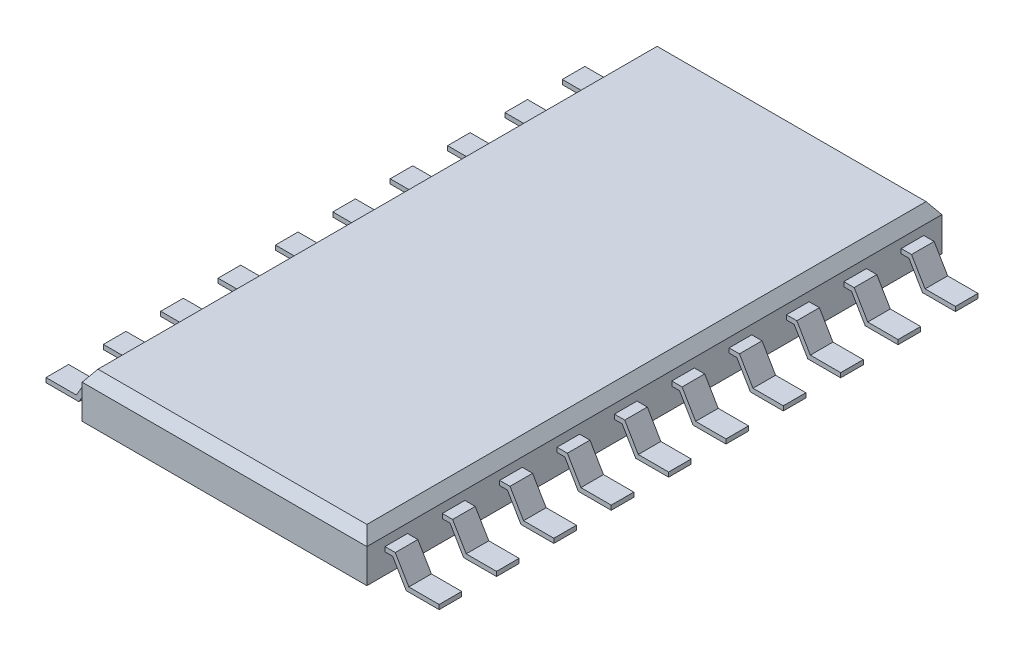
SolidWorks part; units mm, degrees
ref_plane "Front Plane" through (0, 0, 0) normal (0, 0, 1) x (1, 0, 0)
ref_plane "Top Plane" through (0, 0, 0) normal (0, 1, 0) x (1, 0, 0)
ref_plane "Right Plane" through (0, 0, 0) normal (1, 0, 0) x (0, 0, -1)
sketch "Sketch1" plane through (0, 0, 0) normal (0, 1, 0) x (1, 0, 0)
  line L0 (0, 6.8835) -> (0, -6.8835) construction
  line L1 (-5.5575, 0) -> (5.5575, 0) construction
  line L3 (-3.152, 7) -> (3.152, 7)
  line L4 (-3.152, 7) -> (-3.152, -7)
  line L5 (-3.152, -7) -> (3.152, -7)
  line L6 (3.152, 7) -> (3.152, -7)
  dimension "D1" = 6.3041
  dimension "D2" = 14
extrude "Extrude1" add sketch "Sketch1" along normal mid plane 1
chamfer "Chamfer1" distance 0.25 angle 35 4 edges at (0, 0.5, -7) (3.152, 0.5, 0) (0, 0.5, 7) (-3.152, 0.5, 0)
sketch "Sketch4" plane through (0, 0, 0) normal (0, 0, 1) x (1, 0, 0)
  line L0 (0, 1.2724) -> (0, -0.9364) construction
  line L1 (-3.152, 1.8525) -> (-3.152, -1.3157) construction
  line L2 (-3.152, 0.25) -> (-3.152, -0.5) construction
  line L3 (0, 0) -> (-6.2695, 0) construction
  line L4 (-4.352, 1.2724) -> (-4.352, -1.1019) construction
  line L5 (-3.152, 0) -> (-3.352, 0)
  line L6 (-3.352, 0) -> (-3.652, -0.51)
  line L7 (-3.652, -0.51) -> (-4.352, -0.51)
  line L9 (-3.152, -0.5) -> (3.152, -0.5) construction
  point P19 (-3.352, 0)
  point P22 (-3.652, -0.51)
  dimension "D1" = 1.2
  dimension "D2" = 0.01
  dimension "D3" = 0.7
  dimension "D4" = 0.2
extrude "Extrude-Thin1" add sketch "Sketch4" along normal mid plane 0.5 thin
pattern_linear "LPattern1" count 6 spacing 1.27 along (0, 0, -1) count 5 spacing 1.27 along (0, 0, 1) of "Extrude-Thin1"
mirror "Mirror1" about plane through (0, 0, 0) normal (1, 0, 0) of "LPattern1", "Extrude-Thin1"
other "Move Face1" parameters "D1"=1.27
